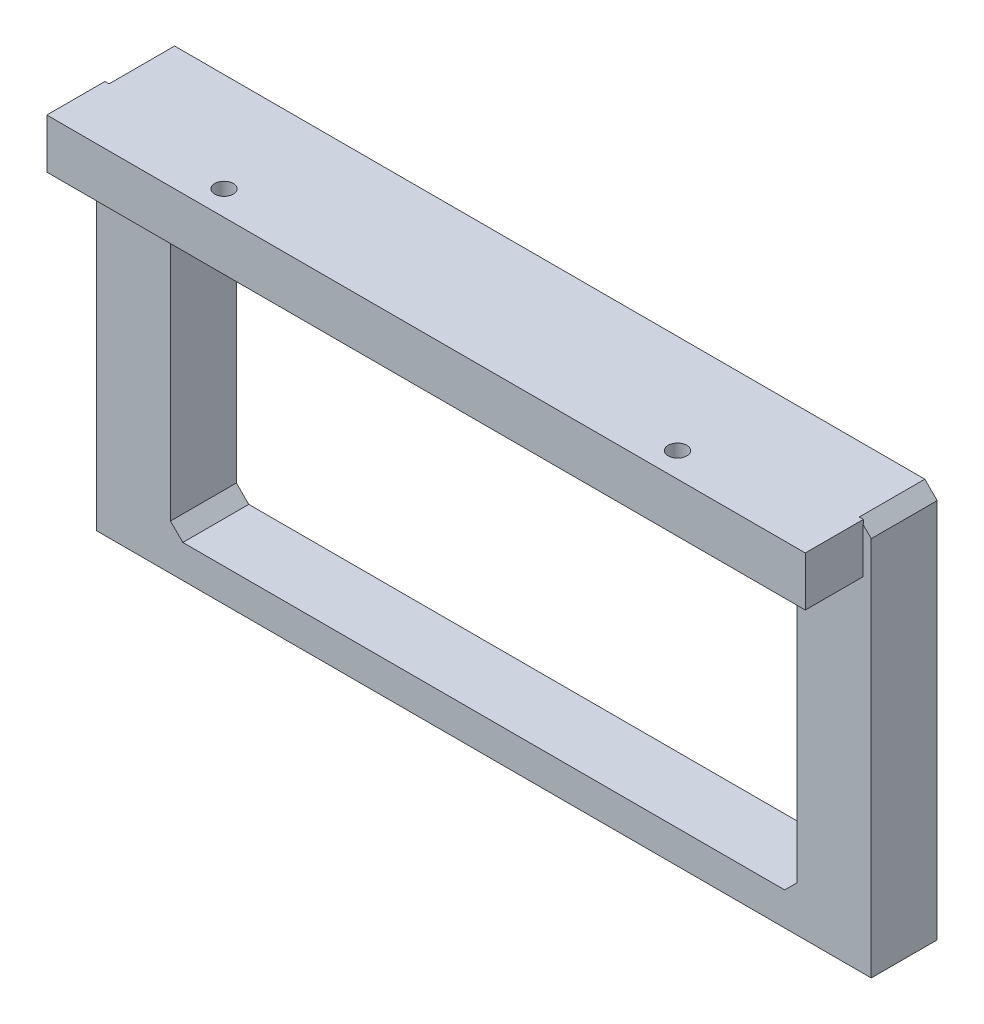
SolidWorks part; units mm, degrees
ref_plane "前视基准面" through (0, 0, 0) normal (0, 0, 1) x (1, 0, 0)
ref_plane "上视基准面" through (0, 0, 0) normal (0, 1, 0) x (1, 0, 0)
ref_plane "右视基准面" through (0, 0, 0) normal (1, 0, 0) x (0, 0, -1)
other "Configuration Table"
sketch "草图1" plane through (0, 0, 0) normal (0, 0, 1) x (1, 0, 0)
  line L0 (-94, 0) -> (94, 0)
  line L1 (94, 0) -> (94, 92.3)
  line L2 (94, 92.3) -> (91, 95.3)
  line L3 (91, 95.3) -> (-91, 95.3)
  line L4 (-91, 95.3) -> (-94, 92.3)
  line L5 (-94, 92.3) -> (-94, 0)
  line L6 (-73, 8) -> (73, 8)
  line L7 (73, 8) -> (76, 11)
  line L8 (76, 11) -> (76, 80.3)
  line L9 (76, 80.3) -> (73, 83.3)
  line L10 (73, 83.3) -> (-73, 83.3)
  line L11 (-73, 83.3) -> (-76, 80.3)
  line L12 (-76, 80.3) -> (-76, 11)
  line L13 (-76, 11) -> (-73, 8)
  dimension "D1" = 73
  dimension "D2" = 76
  dimension "D3" = 91
  dimension "D4" = 94
  dimension "D5" = 73
  dimension "D6" = 91
  dimension "D7" = 8
  dimension "D8" = 11
  dimension "D9" = 80.3
  dimension "D10" = 92.3
extrude "Fixed_side_frame_flat_print" add sketch "草图1" along normal blind 16
sketch "草图2" plane through (0, 0, 0) normal (0, 1, 0) x (1, 0, 0)
  line L0 (-92, -15.9) -> (92, -15.9)
  line L1 (92, -15.9) -> (92, -30)
  line L2 (92, -30) -> (-92, -30)
  line L3 (-92, -30) -> (-92, -15.9)
  circle A0 centre (-55, -24) radius 2.25
  circle A1 centre (55, -24) radius 2.25
  dimension "D1" = 4.5
  dimension "D2" = 55
  dimension "D3" = 92
  dimension "D4" = 55
  dimension "D5" = 92
  dimension "D6" = 15.9
  dimension "D7" = 24
  dimension "D8" = 30
extrude "Inward_ledge_two_vertical_M4_through_holes" add sketch "草图2" along normal blind 12 from offset 83.3
